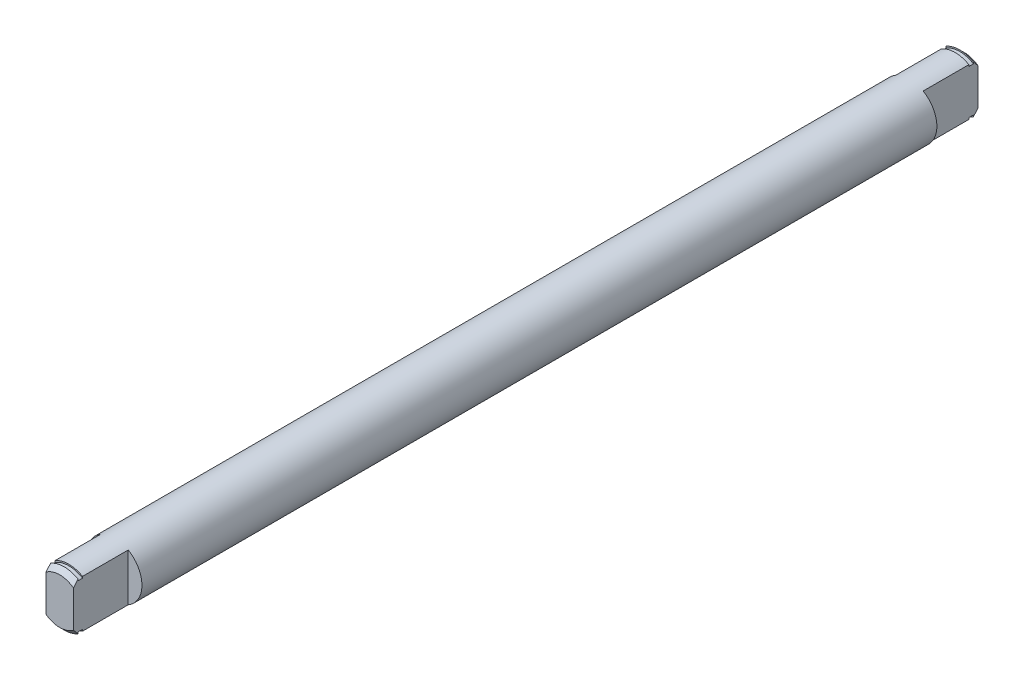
SolidWorks part; units mm, degrees
ref_plane "Face" through (0, 0, 0) normal (0, 0, 1) x (1, 0, 0)
ref_plane "Dessus" through (0, 0, 0) normal (0, 1, 0) x (1, 0, 0)
ref_plane "Droite" through (0, 0, 0) normal (1, 0, 0) x (0, 0, -1)
sketch "Esquisse1" plane through (0, 0, 0) normal (0, 0, 1) x (1, 0, 0)
  circle A0 centre (0, 0) radius 3
  dimension "D1" = 6
extrude "Extrusion1" add sketch "Esquisse1" along normal blind 49.5
chamfer "Chanfrein1" distance 0.5 angle 45 1 edges at (3, 0, 49.5)
sketch "Esquisse2" plane through (0, 0, 0) normal (1, 0, 0) x (0, 0, -1)
  line L0 (0, 0) -> (-38.7627, 0) construction
  line L1 (-48.5, 4.7462) -> (-49, 4.7462)
  line L2 (-48.5, 4.7462) -> (-48.5, 2.85)
  line L3 (-48.5, 2.85) -> (-49, 2.85)
  line L4 (-49, 4.7462) -> (-49, 2.85)
  line L5 (0, -3) -> (0, 3) construction
  dimension "D1" = 48.5
  dimension "D2" = 0.5
  dimension "D3" = 5.7
revolve "Enlèvement de matière-Révolution1" cut sketch "Esquisse2" angle 360 about L0
sketch "Esquisse3" plane through (0, 0, 49.5) normal (0, 0, 1) x (1, 0, 0)
  line L1 (-1.5, 5) -> (1.5, 5)
  line L2 (-1.5, 5) -> (-1.5, -5)
  line L3 (-1.5, -5) -> (1.5, -5)
  line L4 (1.5, 5) -> (1.5, -5)
  dimension "D1" = 3
  dimension "D2" = 1.5
  dimension "D3" = 10
  dimension "D4" = 5
extrude "Enlèv. mat.-Extru.1" cut sketch "Esquisse3" against normal blind 6 flip side to cut
mirror "Symétrie1" about plane through (0, 0, 0) normal (0, 0, 1)
